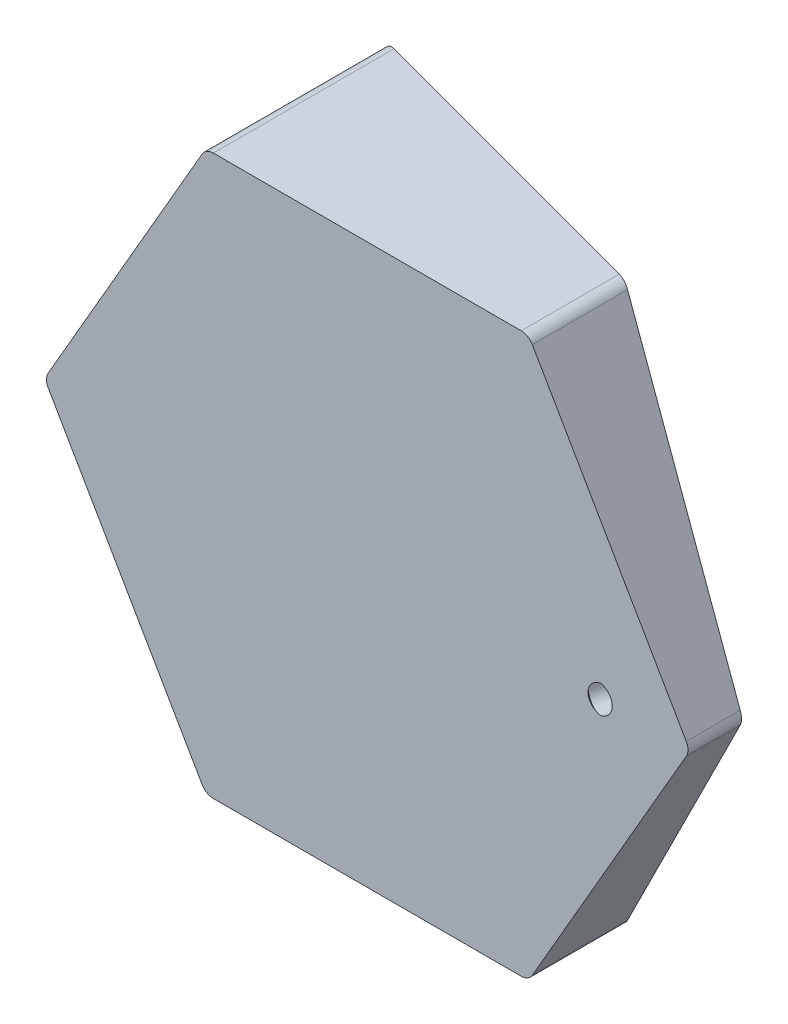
SolidWorks part; units mm, degrees
ref_plane "Front Plane" through (0, 0, 0) normal (0, 0, 1) x (1, 0, 0)
ref_plane "Top Plane" through (0, 0, 0) normal (0, 1, 0) x (1, 0, 0)
ref_plane "Right Plane" through (0, 0, 0) normal (1, 0, 0) x (0, 0, -1)
sketch "Sketch1" plane through (0, 0, 0) normal (0, 0, 1) x (1, 0, 0)
  line L0 (0, 0) -> (50, 0) construction
  line L1 (50, 0) -> (25, 43.3013)
  line L2 (25, 43.3013) -> (-25, 43.3013)
  line L3 (-25, 43.3013) -> (-50, 0)
  line L4 (-50, 0) -> (-25, -43.3013)
  line L5 (-25, -43.3013) -> (25, -43.3013)
  line L6 (25, -43.3013) -> (50, 0)
  circle A0 centre (0, 0) radius 43.3013 construction
  dimension "D1" = 100
extrude "Boss-Extrude1" add sketch "Sketch1" along normal blind 35
sketch "Sketch2" plane through (0, 0, 0) normal (0, 1, 0) x (1, 0, 0)
  line L0 (-50, 0) -> (50, -26.7949)
  line L1 (-47.6314, 0) -> (47.6314, 0) construction
  line L4 (50, -26.7949) -> (50, 0)
  line L5 (50, 0) -> (-50, 0)
  point P4 (-50, 0)
  point P5 (49.2265, -26.5877)
  point P6 (50, 0)
  point P8 (0, 0)
  point P10 (0, 0)
  point P12 (0, 0)
  dimension "D1" = 15
extrude "Cut-Extrude1" cut sketch "Sketch2" against normal through all and the other way through all
sketch "Sketch3" plane through (-3.3494, 0, 12.5) normal (0.2588, 0, -0.9659) x (-0.9659, 0, -0.2588)
  line L0 (-3.4675, 43.3013) -> (-3.4675, -43.3013) construction
  line L1 (22.4144, 43.3013) -> (-29.3494, 43.3013) construction
  line L2 (22.4144, -43.3013) -> (-29.3494, -43.3013) construction
  line L3 (-55.2313, 0) -> (48.2963, 0) construction
  circle A0 centre (-3.4675, 0) radius 17.5
  point P13 (-3.4675, 0)
  dimension "D1" = 35
extrude "Cut-Extrude2" cut sketch "Sketch3" against normal blind 6
hole_wizard "M4x0.7 Tapped Hole1" positions "Sketch6" profile "Sketch5" tap size "M4x0.7" standard "ANSI Metric"
sketch "Sketch6" plane through (-3.3494, 0, 12.5) normal (0.2588, 0, -0.9659) x (-0.9659, 0, -0.2588)
  line L0 (-3.4675, 0) -> (-3.4675, 25) construction
  point P0 (-3.4675, 25)
  point P16 (14.2102, 17.6777)
  point P17 (21.5325, 0)
  point P18 (14.2102, -17.6777)
  point P19 (-3.4675, -25)
  point P20 (-21.1452, -17.6777)
  point P21 (-28.4675, 0)
  point P22 (-21.1452, 17.6777)
  dimension "D1" = 25
  dimension "D2" = 8
sketch "Sketch5" plane through (0, 25, 13.3975) normal (0, 1, 0) x (-0.9659, 0, -0.2588)
  line L0 (0, 0) -> (0, 12.4914)
  line L1 (0, 12.4914) -> (1.65, 11.5)
  line L2 (1.65, 11.5) -> (1.65, 0.375)
  line L3 (1.65, 0.375) -> (2.025, 0)
  line L5 (2.025, 0) -> (0, 0)
  line L6 (-1.65, 0.375) -> (-2.025, 0) construction
  line L10 (0, 12.4914) -> (-1.65, 11.5) construction
  line L11 (0, -6.35) -> (0, 107.95) construction
  dimension "Tap Drill Dia." = 3.3
  dimension "Tap Drill Depth" = 11.5
  dimension "Near C'Sink Dia." = 4.05
  dimension "Near C'Sink Angle" = 90
  dimension "Drill Angle" = 118
fillet "Fillet2" radius 2 6 edges at (-25, 43.3013, 20.8494) (25, 43.3013, 27.5481) (-50, 0, 17.5) (-25, -43.3013, 20.8494) (25, -43.3013, 27.5481) (50, 0, 30.8975)
sketch "Sketch7" plane through (0, 0, 0) normal (0, 1, 0) x (1, 0, 0)
  line L0 (-1.5529, -19.193) -> (-4.1842, -29.0131) construction
  line L1 (15.3508, -23.7223) -> (-18.4566, -14.6637) construction
hole_wizard "CBORE for M4 SHCS1" positions "Sketch8" profile "Sketch9" counterbore size "M4" standard "ANSI Metric"
sketch "Sketch8" plane through (-3.3494, 0, 12.5) normal (0.2588, 0, -0.9659) x (-0.9659, 0, -0.2588)
  line L0 (-3.4675, 0) -> (38.8998, 0) construction
  line L1 (-3.4675, 0) -> (-3.4675, 43.3013) construction
  line L2 (21.219, 43.3013) -> (-28.154, 43.3013) construction
  line L3 (-3.4675, 0) -> (-43.4675, 0) construction
  line L4 (-3.4675, 0) -> (-3.4675, -35) construction
  point P0 (-43.4675, 0)
  point P20 (-3.4675, 35)
  point P22 (-3.4675, -35)
  point P29 (31.5325, 0)
  dimension "D1" = 40
  dimension "D2" = 35
  dimension "D3" = 35
  dimension "D4" = 35
sketch "Sketch9" plane through (38.637, 0, 23.7502) normal (0, 1, 0) x (-0.9659, 0, -0.2588)
  line L0 (0, 0) -> (0, 12.8519)
  line L1 (0, 12.8519) -> (2.25, 11.5)
  line L2 (2.25, 11.5) -> (2.25, 4)
  line L3 (2.25, 4) -> (4, 4)
  line L5 (4, 4) -> (4, 0.025)
  line L6 (4, 0.025) -> (4.025, 0)
  line L7 (4.025, 0) -> (0, 0)
  line L8 (-4, 0.025) -> (-4.025, 0) construction
  line L10 (0, 12.8519) -> (-2.25, 11.5) construction
  line L11 (0, -6.35) -> (0, 107.95) construction
  dimension "Hole Dia." = 4.5
  dimension "Hole Depth" = 11.5
  dimension "C'Bore Dia." = 8
  dimension "C'Bore Depth" = 4
  dimension "Near C'Sink Dia." = 8.05
  dimension "Near C'Sink Angle" = 90
  dimension "Drill Angle" = 118
